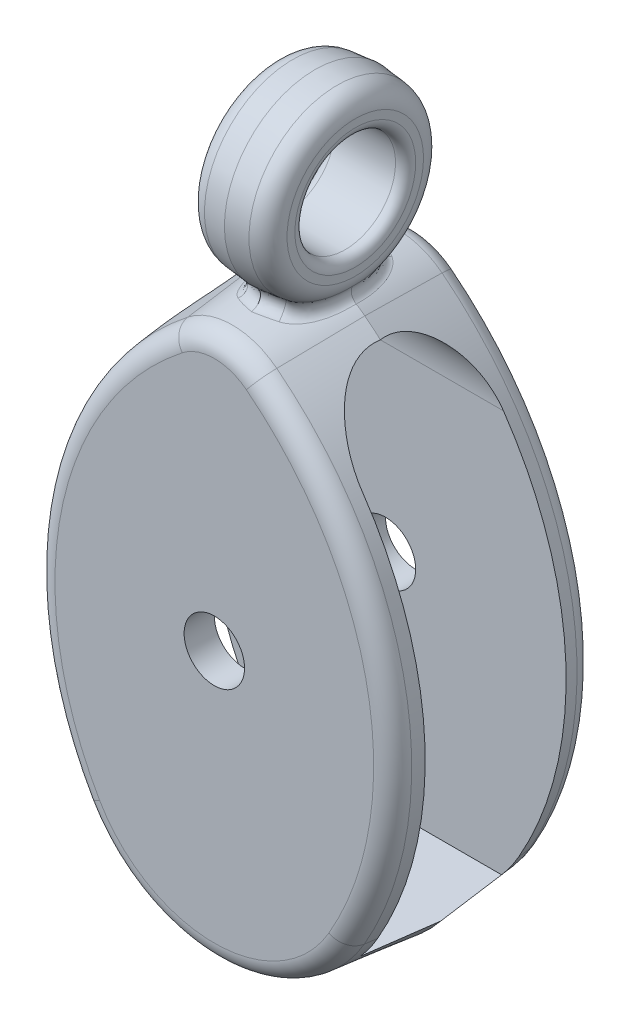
SolidWorks part; units mm, degrees
ref_plane "Front" through (0, 0, 0) normal (0, 0, 1) x (1, 0, 0)
ref_plane "Top" through (0, 0, 0) normal (0, 1, 0) x (1, 0, 0)
ref_plane "Right" through (0, 0, 0) normal (1, 0, 0) x (0, 0, -1)
sketch "Base" plane through (0, 0, 0) normal (0, 0, 1) x (1, 0, 0)
  line L0 (0, 0) -> (0, 16) construction
  arc A0 (-2.4744, 19.1429) -> (2.4744, 19.1429) centre (0, 16) cw
  arc A1 (-6.9282, -4) -> (6.9282, -4) centre (0, 0) ccw
  arc A2 (6.9282, -4) -> (2.4744, 19.1429) centre (-8.6603, 5) ccw
  arc A3 (-6.9282, -4) -> (-2.4744, 19.1429) centre (8.6603, 5) cw
  dimension "D2" = 4
  dimension "D3" = 8
  dimension "D4" = 18
  dimension "D1" = 16
sketch "Hanger" plane through (0, 0, 0) normal (1, 0, 0) x (0, 0, -1)
  line L1 (0, 0) -> (0, 16) construction
  circle A0 centre (0, 24) radius 4.5
  dimension "D2" = 9
  dimension "D1" = 24
sketch "Center Cut" plane through (0, 0, 0) normal (1, 0, 0) x (0, 0, -1)
  line L0 (-3.5, -5) -> (-3.5, 15)
  line L1 (-3.5, -5) -> (3.5, -5)
  line L2 (3.5, -5) -> (3.5, 15)
  arc A0 (3.5, 15) -> (-3.5, 15) centre (0, 15) ccw
  circle A2 centre (0, 24) radius 4.5 construction
  dimension "D1" = 9
  dimension "D2" = 20
  dimension "D3" = 7
extrude "Boss-Extrude1" add sketch "Base" along normal mid plane 10 draft 6
extrude "Boss-Extrude2" add sketch "Hanger" along normal mid plane 4 draft 6
extrude "Cut-Extrude1" cut sketch "Center Cut" against normal up to next and the other way through all
hole_wizard "Ø5.0 (5) Diameter Hole1" positions "Sketch4" profile "Sketch3" hole size "Ø5.0" standard "ANSI Metric"
sketch "Sketch4" plane through (2, 0, 0) normal (1, 0, 0) x (0, 0, -1)
  point P0 (0, 24)
sketch "Sketch3" plane through (2, 24, 0) normal (0, 1, 0) x (0, 0, -1)
  line L0 (0, 0) -> (0, 10.9719)
  line L1 (0, 10.9719) -> (2.5, 10.9719)
  line L2 (2.5, 10.9719) -> (2.5, 0)
  line L5 (2.5, 0) -> (0, 0)
  line L11 (0, -6.35) -> (0, 107.95) construction
  dimension "Thru Hole Dia." = 5
  dimension "Thru Hole Depth" = 10.9719
hole_wizard "Ø3.0 (3) Diameter Hole1" positions "Sketch2" profile "Sketch1" hole size "Ø3.0" standard "ANSI Metric"
sketch "Sketch2" plane through (0, 0, 5) normal (0, 0, 1) x (1, 0, 0)
  point P0 (0, 6)
  dimension "D1" = 6
sketch "Sketch1" plane through (0, 6, 5) normal (1, 0, 0) x (0, -1, 0)
  line L0 (0, 0) -> (0, 10)
  line L1 (0, 10) -> (1.5, 10)
  line L2 (1.5, 10) -> (1.5, 0)
  line L5 (1.5, 0) -> (0, 0)
  line L11 (0, -6.35) -> (0, 107.95) construction
  dimension "Thru Hole Dia." = 3
  dimension "Thru Hole Depth" = 10
fillet "Fillet-1" radius 1 10 edges at (8.4993, 8.3024, -5) (0, 19.4745, -5) (-8.4993, 8.3024, 5) (0, -7.4745, 5) (8.4993, 8.3024, 5) (0, 19.4745, 5) (-2, 24, -4.2898) (2, 24, -4.2898) (-8.4993, 8.3024, -5) (0, -7.4745, -5)
fillet "Fillet-0.5" radius 0.5 10 edges at (-2, 24, -2.5) (2, 24, -2.5) (1.3141, 19.7075, -0.6322) (1.2992, 19.7085, 0.6707) (0.4554, 19.8136, 1.5152) (0.4554, 19.8136, -1.5152) (-0.4554, 19.8136, -1.5152) (-0.4554, 19.8136, 1.5152) (-1.3141, 19.7075, 0.6322) (-1.2992, 19.7085, -0.6707)
